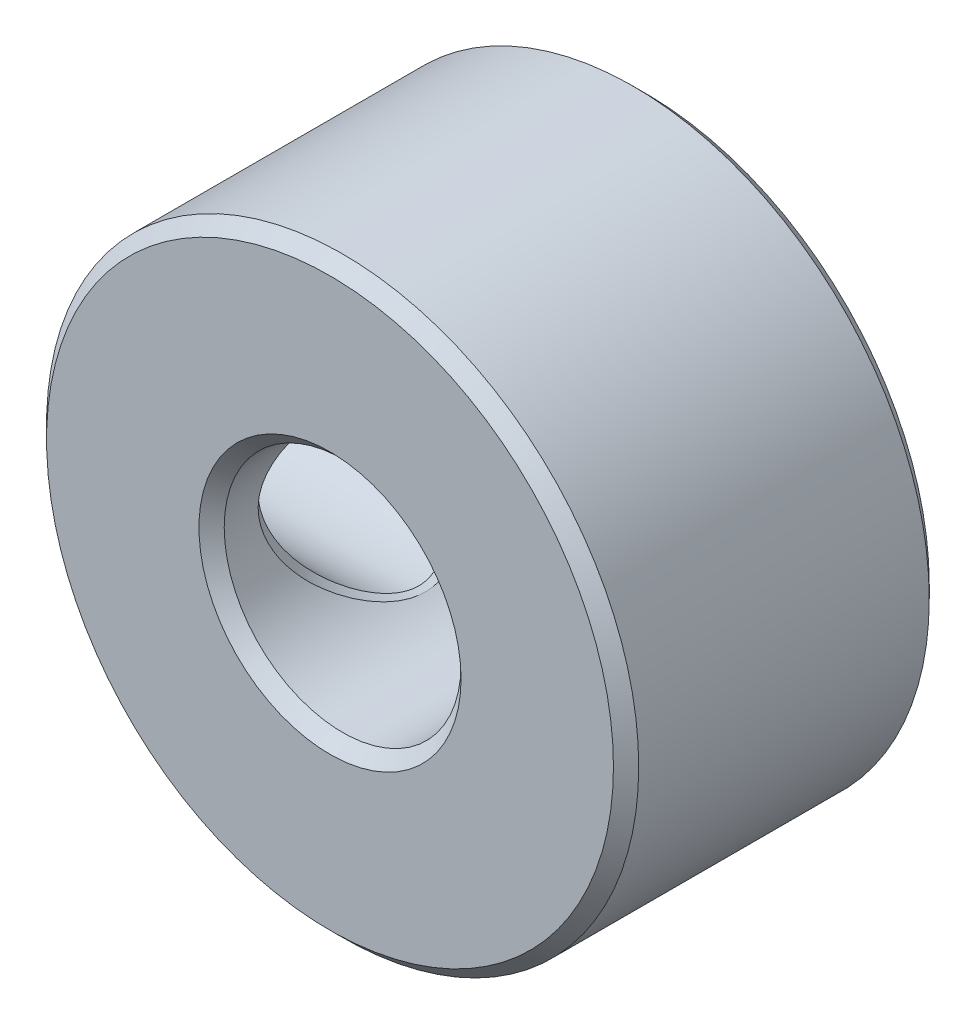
SolidWorks part; units mm, degrees
ref_plane "Front Plane" through (0, 0, 0) normal (0, 0, 1) x (1, 0, 0)
ref_plane "Top Plane" through (0, 0, 0) normal (0, 1, 0) x (1, 0, 0)
ref_plane "Right Plane" through (0, 0, 0) normal (1, 0, 0) x (0, 0, -1)
sketch "Sketch1" plane through (0, 0, 0) normal (0, 0, 1) x (1, 0, 0)
  circle A0 centre (0, 0) radius 5.9531
  circle A1 centre (0, 0) radius 2.3813
  dimension "D1" = 4.7625
  dimension "D2" = 11.9062
extrude "Extrude1" add sketch "Sketch1" along normal mid plane 6.35
sketch "Sketch2" plane through (0, 0, 0) normal (1, 0, 0) x (0, 0, -1)
  circle A0 centre (0, 0) radius 1.9844
  dimension "D1" = 3.9688
extrude "Cut-Extrude1" cut sketch "Sketch2" against normal blind 6.35
chamfer "Chamfer1" distance 0.254 angle 45 6 edges at (5.9531, 0, -3.175) (5.9531, 0, 3.175) (2.3813, 0, -3.175) (2.3813, 0, 3.175) (-2.3798, 0.0817, -1.9827) (-5.9436, 0.3372, -1.9555)
